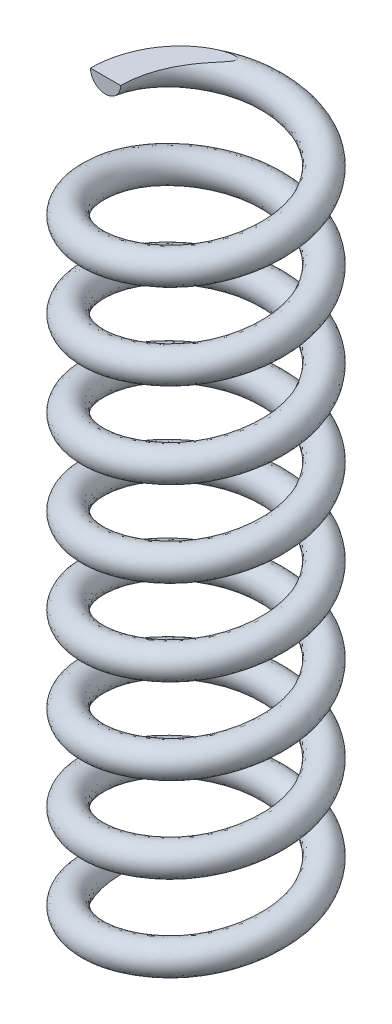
SolidWorks part; units mm, degrees
ref_plane "Front Plane" through (0, 0, 0) normal (0, 0, 1) x (1, 0, 0)
ref_plane "Top Plane" through (0, 0, 0) normal (0, 1, 0) x (1, 0, 0)
ref_plane "Right Plane" through (0, 0, 0) normal (1, 0, 0) x (0, 0, -1)
sketch "Sketch1" plane through (0, 0, 0) normal (0, 0, 1) x (1, 0, 0)
  line L0 (0, 34.6745) -> (0, 80)
  line L1 (-6.5, 34.6745) -> (6.5, 34.6745) construction
  line L2 (-6.5876, 80) -> (4.3429, 80) construction
sketch "Sketch2" plane through (0, 0, 0) normal (0, 0, 1) x (1, 0, 0)
  line L0 (0, 34.6745) -> (0, 80) construction
  circle A0 centre (-6, 34.6745) radius 1
  dimension "D1" = 2
  dimension "D2" = 6
sweep "Sweep1" add profiles "Sketch2" path "Sketch1" parameters "D4"=2880
ref_plane "Plane1" through (0, 80, 0) normal (0, -1, 0) x (-1, 0, 0)
ref_plane "Plane2" through (0, 34.6745, 0) normal (0, 1, 0) x (1, 0, 0)
other "SurfaceCut1"
other "SurfaceCut2"
